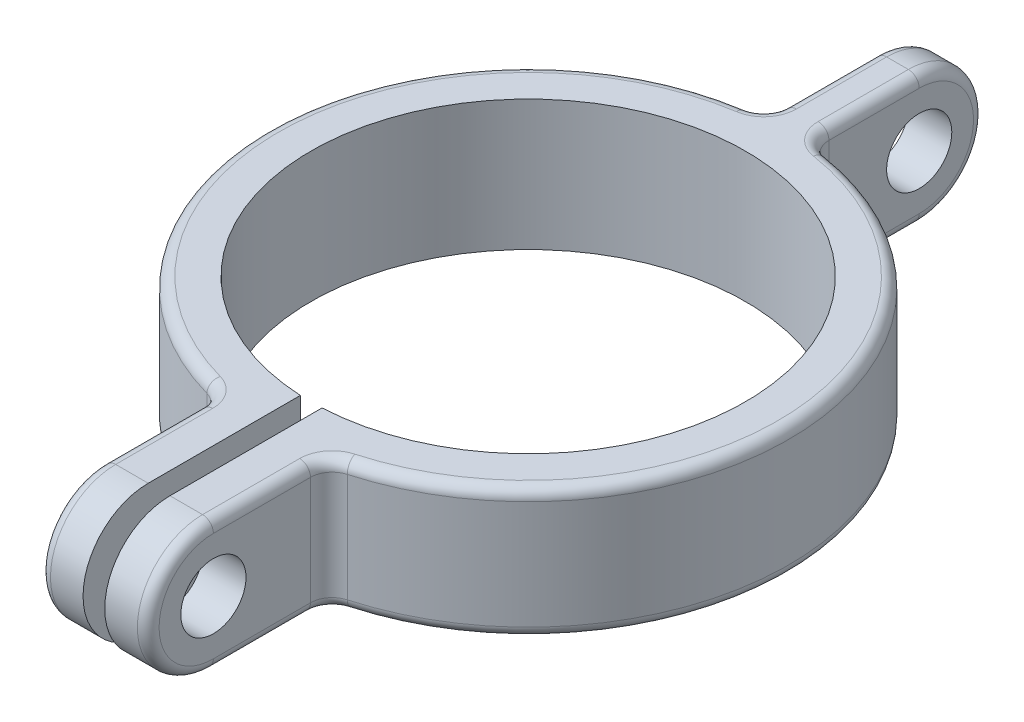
SolidWorks part; units mm, degrees
ref_plane "Front" through (0, 0, 0) normal (0, 0, 1) x (1, 0, 0)
ref_plane "Top" through (0, 0, 0) normal (0, 1, 0) x (1, 0, 0)
ref_plane "Right" through (0, 0, 0) normal (1, 0, 0) x (0, 0, -1)
sketch "Sketch1" plane through (0, 0, 0) normal (0, 1, 0) x (1, 0, 0)
  circle A0 centre (0, 0) radius 38.1
  circle A1 centre (0, 0) radius 31.75
  dimension "D1" = 63.5
  dimension "D2" = 76.2
extrude "Extrude1" add sketch "Sketch1" along normal blind 19.05
sketch "Sketch2" plane through (0, 19.05, 0) normal (0, 1, 0) x (-1, 0, 0)
  line L1 (-1.5875, 0) -> (1.5875, 0)
  line L2 (-1.5875, 0) -> (-1.5875, 40.64)
  line L3 (-1.5875, 40.64) -> (1.5875, 40.64)
  line L4 (1.5875, 0) -> (1.5875, 40.64)
  circle A0 centre (0, 0) radius 38.1 construction
  dimension "D2" = 2.54
  dimension "D1" = 3.175
extrude "Cut-Extrude1" cut sketch "Sketch2" against normal through all
sketch "Sketch3" plane through (1.5875, 0, 0) normal (-1, 0, 0) x (0, 0, 1)
  line L0 (31.7103, 19.05) -> (53.9419, 19.05)
  line L1 (53.9419, 0) -> (31.7103, 0)
  line L2 (31.7103, 19.05) -> (31.7103, 0)
  line L3 (38.0669, 0) -> (38.0669, 19.05) construction
  arc A0 (53.9419, 19.05) -> (53.9419, 0) centre (53.9419, 9.525) cw
  dimension "D1" = 15.875
extrude "Extrude2" add sketch "Sketch3" against normal blind 6.35
mirror "Mirror1" about plane through (0, 0, 0) normal (1, 0, 0)
sketch "Sketch6" plane through (7.9375, 0, 0) normal (1, 0, 0) x (0, 0, -1)
  circle A0 centre (-53.9419, 9.525) radius 4.7625
  dimension "D1" = 9.525
extrude "Cut-Extrude3" cut sketch "Sketch6" against normal through all
sketch "Sketch7" plane through (0, 0, 0) normal (1, 0, 0) x (0, 0, -1)
  line L0 (31.75, 19.05) -> (53.975, 19.05)
  line L2 (53.975, 0) -> (31.75, 0)
  line L4 (31.75, 0) -> (31.75, 19.05)
  line L9 (38.1, 0) -> (38.1, 19.05) construction
  arc A0 (53.975, 19.05) -> (53.975, 0) centre (53.975, 9.525) cw
  dimension "D1" = 15.875
extrude "Extrude4" add sketch "Sketch7" along normal mid plane 6.35
fillet "Fillet4" radius 3.175
sketch "Sketch10" plane through (3.175, 0, 0) normal (1, 0, 0) x (0, 0, -1)
  circle A0 centre (53.975, 9.525) radius 4.7625
  dimension "D1" = 9.525
extrude "Cut-Extrude6" cut sketch "Sketch10" against normal through all
fillet "Fillet5" radius 1.5875
